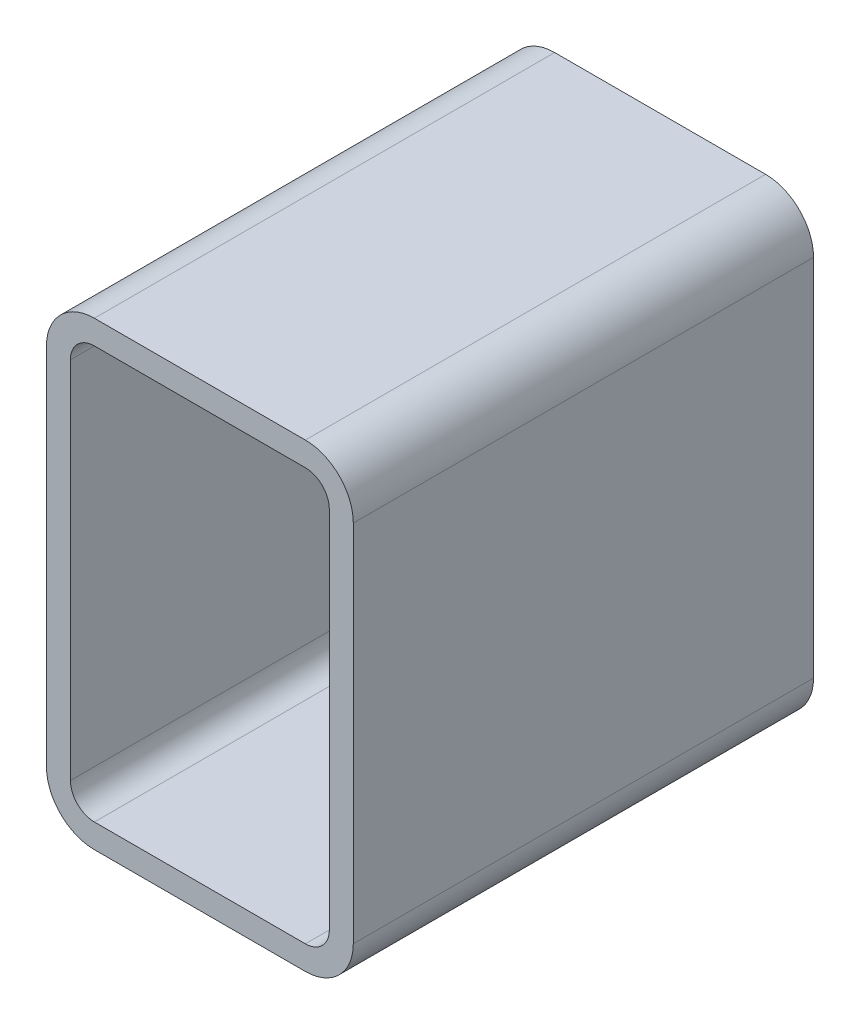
SolidWorks part; units mm, degrees
ref_plane "Front Plane" through (0, 0, 0) normal (0, 0, 1) x (1, 0, 0)
ref_plane "Top Plane" through (0, 0, 0) normal (0, 1, 0) x (1, 0, 0)
ref_plane "Right Plane" through (0, 0, 0) normal (1, 0, 0) x (0, 0, -1)
sketch "Sketch1" plane through (0, 0, 0) normal (0, 0, 1) x (1, 0, 0)
sketch_block_instance "HSS12x8x0.625-1"
sketch_block "HSS12x8x0.625"
extrude "Boss-Extrude1" add sketch "Sketch1" along normal blind 304.8
